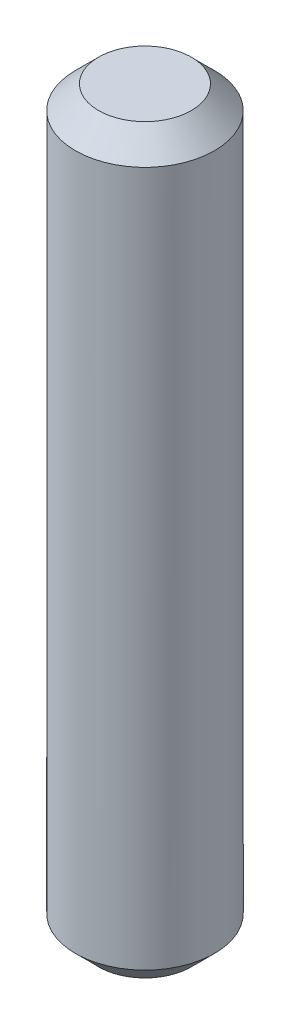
SolidWorks part; units mm, degrees
ref_plane "Front" through (0, 0, 0) normal (0, 0, 1) x (1, 0, 0)
ref_plane "Top" through (0, 0, 0) normal (0, 1, 0) x (1, 0, 0)
ref_plane "Right" through (0, 0, 0) normal (1, 0, 0) x (0, 0, -1)
sketch "Sketch1" plane through (0, 0, 0) normal (0, 0, 1) x (1, 0, 0)
  line L0 (0, 14.134) -> (0, -8.6107) construction
  line L1 (0, 4) -> (0.75, 4)
  line L2 (0, 4) -> (0, -4)
  line L3 (0, -4) -> (0.75, -4)
  line L4 (0.75, 4) -> (0.75, -4)
  dimension "D1" = 0.75
  dimension "D2" = 8
revolve "Revolve1" add sketch "Sketch1" angle 360 about L0
chamfer "Chamfer1" distance 0.25 angle 45 2 edges at (-0.75, -4, 0) (-0.75, 4, 0)
